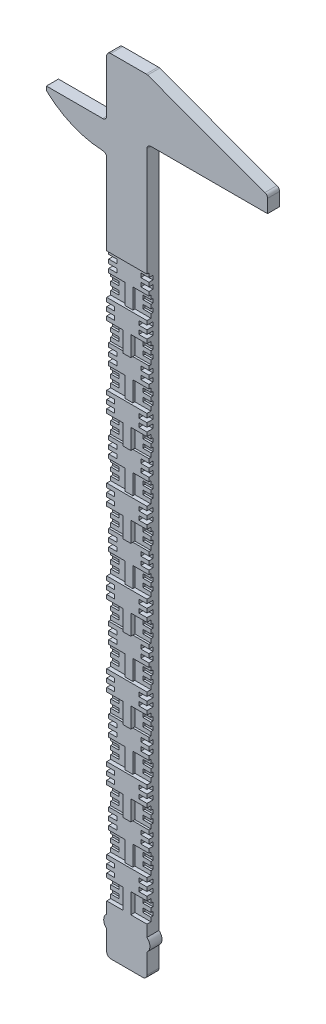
SolidWorks part; units mm, degrees
ref_plane "Plan de face" through (0, 0, 0) normal (0, 0, 1) x (1, 0, 0)
ref_plane "Plan de dessus" through (0, 0, 0) normal (0, 1, 0) x (1, 0, 0)
ref_plane "Plan de droite" through (0, 0, 0) normal (1, 0, 0) x (0, 0, -1)
sketch "Esquisse1" plane through (0, 0, 0) normal (0, 0, 1) x (1, 0, 0)
  line L0 (10.1667, 14.9389) -> (39.3443, 4.2404)
  line L3 (1, -180) -> (9, -180)
  line L4 (10, -1) -> (10, -170.8775)
  line L5 (-15, 0) -> (-15, -1)
  line L6 (11, 0) -> (40, 0)
  line L7 (40, 0) -> (40, 3.3016)
  line L8 (1, 15) -> (9.8224, 15)
  line L9 (0, -179) -> (0, -174)
  line L10 (-15, 0) -> (-1, 0)
  line L11 (0, 1) -> (0, 14)
  line L12 (5, -180) -> (5, -172.4538) construction
  line L13 (10, -174) -> (10, -179)
  line L14 (0, -170.8775) -> (0, -7.9099)
  arc A0 (-15, -1) -> (-0.9564, -6.9108) centre (0, 15) ccw
  arc A1 (0, -7.9099) -> (-0.9564, -6.9108) centre (-1, -7.9099) ccw
  arc A2 (-1, 0) -> (0, 1) centre (-1, 1) ccw
  arc A3 (11, 0) -> (10, -1) centre (11, -1) ccw
  arc A4 (40, 3.3016) -> (39.3443, 4.2404) centre (39, 3.3016) ccw
  arc A5 (9.8224, 15) -> (10.1667, 14.9389) centre (9.8224, 14) cw
  arc A6 (1, 15) -> (0, 14) centre (1, 14) ccw
  arc A7 (0, -179) -> (1, -180) centre (1, -179) ccw
  arc A8 (9, -180) -> (10, -179) centre (9, -179) ccw
  arc A9 (10, -170.8775) -> (10, -174) centre (8.75, -172.4388) cw
  arc A10 (0, -170.8775) -> (0, -174) centre (1.25, -172.4388) ccw
  point P20 (0, 0)
  point P23 (10, 0)
  point P26 (40, 4)
  point P29 (10, 15)
  point P35 (0, -180)
  point P38 (10, -180)
  point P41 (0, 0)
  dimension "D8" = 1
  dimension "D9" = 1
  dimension "D10" = 2
  dimension "D1" = 10
  dimension "D2" = 15
  dimension "D3" = 1
  dimension "D4" = 4
  dimension "D5" = 15
  dimension "D6" = 30
  dimension "D7" = 180
  dimension "D11" = 3.75
  dimension "D12" = 5
extrude "Boss.-Extru.1" add sketch "Esquisse1" along normal blind 3
sketch "Esquisse3" plane through (10, 0, 0) normal (1, 0, 0) x (0, 0, -1)
  line L0 (-6, -28.0143) -> (-2.5, -28.0143)
  line L1 (-2.5, -28.0143) -> (-2.5, -38.0143)
  line L2 (-5.9, -28.0143) -> (-6, -28.0143) construction
  line L3 (-2.5, -38.0143) -> (-6, -38.0143)
  line L4 (-6, -28.0143) -> (-6, -38.0143)
  line L5 (-6, -41.6651) -> (-6, -14.3635) construction
  line L6 (-3, -41.6651) -> (-3, -14.3635) construction
  line L7 (-6, -48.0143) -> (-6, -58.0143)
  line L8 (-2.5, -58.0143) -> (-6, -58.0143)
  line L9 (-2.5, -48.0143) -> (-2.5, -58.0143)
  line L10 (-6, -48.0143) -> (-2.5, -48.0143)
  line L11 (-6, -68.0143) -> (-6, -78.0143)
  line L12 (-2.5, -78.0143) -> (-6, -78.0143)
  line L13 (-2.5, -68.0143) -> (-2.5, -78.0143)
  line L14 (-6, -68.0143) -> (-2.5, -68.0143)
  line L15 (-6, -88.0143) -> (-6, -98.0143)
  line L16 (-2.5, -98.0143) -> (-6, -98.0143)
  line L17 (-2.5, -88.0143) -> (-2.5, -98.0143)
  line L18 (-6, -88.0143) -> (-2.5, -88.0143)
  line L19 (-6, -108.0143) -> (-6, -118.0143)
  line L20 (-2.5, -118.0143) -> (-6, -118.0143)
  line L21 (-2.5, -108.0143) -> (-2.5, -118.0143)
  line L22 (-6, -108.0143) -> (-2.5, -108.0143)
  line L23 (-6, -128.0143) -> (-6, -138.0143)
  line L24 (-2.5, -138.0143) -> (-6, -138.0143)
  line L25 (-2.5, -128.0143) -> (-2.5, -138.0143)
  line L26 (-6, -128.0143) -> (-2.5, -128.0143)
  line L27 (-6, -148.0143) -> (-6, -158.0143)
  line L28 (-2.5, -158.0143) -> (-6, -158.0143)
  line L29 (-2.5, -148.0143) -> (-2.5, -158.0143)
  line L30 (-6, -148.0143) -> (-2.5, -148.0143)
  point P2 (0, 0)
  dimension "D1" = 0.5
  dimension "D2" = 10
  dimension "D4" = 10
  dimension "D3" = 7
extrude "Enlèv. mat.-Extru.2" cut sketch "Esquisse3" against normal up to vertex (10 mm away)
sketch "Esquisse4" plane through (10, 0, 0) normal (1, 0, 0) x (0, 0, -1)
  line L1 (-7.9219, -33.0143) -> (-2, -33.0143)
  line L2 (-7.9219, -33.0143) -> (-7.9219, -38.0143)
  line L3 (-7.9219, -38.0143) -> (-2, -38.0143)
  line L4 (-2, -33.0143) -> (-2, -38.0143)
  line L5 (-5.9, -28.0143) -> (-6, -28.0143) construction
  line L6 (-3, -48.0143) -> (-3, -38.0143) construction
  line L7 (-7.9219, -48.0143) -> (-2, -48.0143)
  line L8 (-7.9219, -43.0143) -> (-7.9219, -48.0143)
  line L9 (-2, -43.0143) -> (-2, -48.0143)
  line L10 (-7.9219, -43.0143) -> (-2, -43.0143)
  line L11 (-7.9219, -58.0143) -> (-2, -58.0143)
  line L12 (-7.9219, -53.0143) -> (-7.9219, -58.0143)
  line L13 (-2, -53.0143) -> (-2, -58.0143)
  line L14 (-7.9219, -53.0143) -> (-2, -53.0143)
  line L15 (-7.9219, -68.0143) -> (-2, -68.0143)
  line L16 (-7.9219, -63.0143) -> (-7.9219, -68.0143)
  line L17 (-2, -63.0143) -> (-2, -68.0143)
  line L18 (-7.9219, -63.0143) -> (-2, -63.0143)
  line L19 (-7.9219, -78.0143) -> (-2, -78.0143)
  line L20 (-7.9219, -73.0143) -> (-7.9219, -78.0143)
  line L21 (-2, -73.0143) -> (-2, -78.0143)
  line L22 (-7.9219, -73.0143) -> (-2, -73.0143)
  line L23 (-7.9219, -88.0143) -> (-2, -88.0143)
  line L24 (-7.9219, -83.0143) -> (-7.9219, -88.0143)
  line L25 (-2, -83.0143) -> (-2, -88.0143)
  line L26 (-7.9219, -83.0143) -> (-2, -83.0143)
  line L27 (-7.9219, -98.0143) -> (-2, -98.0143)
  line L28 (-7.9219, -93.0143) -> (-7.9219, -98.0143)
  line L29 (-2, -93.0143) -> (-2, -98.0143)
  line L30 (-7.9219, -93.0143) -> (-2, -93.0143)
  line L31 (-7.9219, -108.0143) -> (-2, -108.0143)
  line L32 (-7.9219, -103.0143) -> (-7.9219, -108.0143)
  line L33 (-2, -103.0143) -> (-2, -108.0143)
  line L34 (-7.9219, -103.0143) -> (-2, -103.0143)
  line L35 (-7.9219, -118.0143) -> (-2, -118.0143)
  line L36 (-7.9219, -113.0143) -> (-7.9219, -118.0143)
  line L37 (-2, -113.0143) -> (-2, -118.0143)
  line L38 (-7.9219, -113.0143) -> (-2, -113.0143)
  line L39 (-7.9219, -128.0143) -> (-2, -128.0143)
  line L40 (-7.9219, -123.0143) -> (-7.9219, -128.0143)
  line L41 (-2, -123.0143) -> (-2, -128.0143)
  line L42 (-7.9219, -123.0143) -> (-2, -123.0143)
  line L43 (-7.9219, -138.0143) -> (-2, -138.0143)
  line L44 (-7.9219, -133.0143) -> (-7.9219, -138.0143)
  line L45 (-2, -133.0143) -> (-2, -138.0143)
  line L46 (-7.9219, -133.0143) -> (-2, -133.0143)
  line L47 (-7.9219, -148.0143) -> (-2, -148.0143)
  line L48 (-7.9219, -143.0143) -> (-7.9219, -148.0143)
  line L49 (-2, -143.0143) -> (-2, -148.0143)
  line L50 (-7.9219, -143.0143) -> (-2, -143.0143)
  line L51 (-7.9219, -158.0143) -> (-2, -158.0143)
  line L52 (-7.9219, -153.0143) -> (-7.9219, -158.0143)
  line L53 (-2, -153.0143) -> (-2, -158.0143)
  line L54 (-7.9219, -153.0143) -> (-2, -153.0143)
  line L55 (-7.9219, -168.0143) -> (-2, -168.0143)
  line L56 (-7.9219, -163.0143) -> (-7.9219, -168.0143)
  line L57 (-2, -163.0143) -> (-2, -168.0143)
  line L58 (-7.9219, -163.0143) -> (-2, -163.0143)
  dimension "D1" = 5
  dimension "D2" = 5
  dimension "D3" = 1
  dimension "D4" = 5.9219
  dimension "D6" = 5
  dimension "D5" = 14
extrude "Enlèv. mat.-Extru.3" cut sketch "Esquisse4" against normal blind 4
ref_plane "Plan1" through (5, 0, 0) normal (-1, 0, 0) x (0, 0, 1)
mirror "Symétrie1" about plane through (5, 0, 0) normal (-1, 0, 0) of "Enlèv. mat.-Extru.3"
sketch "Esquisse5" plane through (10, 0, 0) normal (1, 0, 0) x (0, 0, -1)
  line L0 (-3, -168.0143) -> (-2, -168.0143) construction
  line L1 (-1.5, -166.0143) -> (-9.9964, -166.0143)
  line L2 (-1.5, -166.0143) -> (-1.5, -167.0143)
  line L3 (-1.5, -167.0143) -> (-9.9964, -167.0143)
  line L4 (-9.9964, -166.0143) -> (-9.9964, -167.0143)
  line L5 (0, -170.8775) -> (0, -1) construction
  line L6 (-3, -170.8775) -> (-3, -168.0143) construction
  line L7 (-2, -165.5143) -> (-7.8593, -165.5143) construction
  line L8 (-2, -168.0143) -> (-2, -163.0143) construction
  line L9 (-1.5, -165.0143) -> (-1.5, -164.0143)
  line L10 (-1.5, -164.0143) -> (-9.9964, -164.0143)
  line L11 (-1.5, -165.0143) -> (-9.9964, -165.0143)
  line L12 (-9.9964, -165.0143) -> (-9.9964, -164.0143)
  line L13 (-9.9964, -160.0143) -> (-9.9964, -159.0143)
  line L14 (-1.5, -159.0143) -> (-9.9964, -159.0143)
  line L15 (-1.5, -160.0143) -> (-9.9964, -160.0143)
  line L16 (-1.5, -160.0143) -> (-1.5, -159.0143)
  line L17 (-1.5, -162.0143) -> (-9.9964, -162.0143)
  line L18 (-9.9964, -161.0143) -> (-9.9964, -162.0143)
  line L19 (-1.5, -161.0143) -> (-9.9964, -161.0143)
  line L20 (-1.5, -161.0143) -> (-1.5, -162.0143)
  line L21 (-9.9964, -155.0143) -> (-9.9964, -154.0143)
  line L22 (-1.5, -154.0143) -> (-9.9964, -154.0143)
  line L23 (-1.5, -155.0143) -> (-9.9964, -155.0143)
  line L24 (-1.5, -155.0143) -> (-1.5, -154.0143)
  line L25 (-1.5, -157.0143) -> (-9.9964, -157.0143)
  line L26 (-9.9964, -156.0143) -> (-9.9964, -157.0143)
  line L27 (-1.5, -156.0143) -> (-9.9964, -156.0143)
  line L28 (-1.5, -156.0143) -> (-1.5, -157.0143)
  line L29 (-9.9964, -150.0143) -> (-9.9964, -149.0143)
  line L30 (-1.5, -149.0143) -> (-9.9964, -149.0143)
  line L31 (-1.5, -150.0143) -> (-9.9964, -150.0143)
  line L32 (-1.5, -150.0143) -> (-1.5, -149.0143)
  line L33 (-1.5, -152.0143) -> (-9.9964, -152.0143)
  line L34 (-9.9964, -151.0143) -> (-9.9964, -152.0143)
  line L35 (-1.5, -151.0143) -> (-9.9964, -151.0143)
  line L36 (-1.5, -151.0143) -> (-1.5, -152.0143)
  line L37 (-9.9964, -145.0143) -> (-9.9964, -144.0143)
  line L38 (-1.5, -144.0143) -> (-9.9964, -144.0143)
  line L39 (-1.5, -145.0143) -> (-9.9964, -145.0143)
  line L40 (-1.5, -145.0143) -> (-1.5, -144.0143)
  line L41 (-1.5, -147.0143) -> (-9.9964, -147.0143)
  line L42 (-9.9964, -146.0143) -> (-9.9964, -147.0143)
  line L43 (-1.5, -146.0143) -> (-9.9964, -146.0143)
  line L44 (-1.5, -146.0143) -> (-1.5, -147.0143)
  line L45 (-9.9964, -140.0143) -> (-9.9964, -139.0143)
  line L46 (-1.5, -139.0143) -> (-9.9964, -139.0143)
  line L47 (-1.5, -140.0143) -> (-9.9964, -140.0143)
  line L48 (-1.5, -140.0143) -> (-1.5, -139.0143)
  line L49 (-1.5, -142.0143) -> (-9.9964, -142.0143)
  line L50 (-9.9964, -141.0143) -> (-9.9964, -142.0143)
  line L51 (-1.5, -141.0143) -> (-9.9964, -141.0143)
  line L52 (-1.5, -141.0143) -> (-1.5, -142.0143)
  line L53 (-9.9964, -135.0143) -> (-9.9964, -134.0143)
  line L54 (-1.5, -134.0143) -> (-9.9964, -134.0143)
  line L55 (-1.5, -135.0143) -> (-9.9964, -135.0143)
  line L56 (-1.5, -135.0143) -> (-1.5, -134.0143)
  line L57 (-1.5, -137.0143) -> (-9.9964, -137.0143)
  line L58 (-9.9964, -136.0143) -> (-9.9964, -137.0143)
  line L59 (-1.5, -136.0143) -> (-9.9964, -136.0143)
  line L60 (-1.5, -136.0143) -> (-1.5, -137.0143)
  line L61 (-9.9964, -130.0143) -> (-9.9964, -129.0143)
  line L62 (-1.5, -129.0143) -> (-9.9964, -129.0143)
  line L63 (-1.5, -130.0143) -> (-9.9964, -130.0143)
  line L64 (-1.5, -130.0143) -> (-1.5, -129.0143)
  line L65 (-1.5, -132.0143) -> (-9.9964, -132.0143)
  line L66 (-9.9964, -131.0143) -> (-9.9964, -132.0143)
  line L67 (-1.5, -131.0143) -> (-9.9964, -131.0143)
  line L68 (-1.5, -131.0143) -> (-1.5, -132.0143)
  line L69 (-9.9964, -125.0143) -> (-9.9964, -124.0143)
  line L70 (-1.5, -124.0143) -> (-9.9964, -124.0143)
  line L71 (-1.5, -125.0143) -> (-9.9964, -125.0143)
  line L72 (-1.5, -125.0143) -> (-1.5, -124.0143)
  line L73 (-1.5, -127.0143) -> (-9.9964, -127.0143)
  line L74 (-9.9964, -126.0143) -> (-9.9964, -127.0143)
  line L75 (-1.5, -126.0143) -> (-9.9964, -126.0143)
  line L76 (-1.5, -126.0143) -> (-1.5, -127.0143)
  line L77 (-9.9964, -120.0143) -> (-9.9964, -119.0143)
  line L78 (-1.5, -119.0143) -> (-9.9964, -119.0143)
  line L79 (-1.5, -120.0143) -> (-9.9964, -120.0143)
  line L80 (-1.5, -120.0143) -> (-1.5, -119.0143)
  line L81 (-1.5, -122.0143) -> (-9.9964, -122.0143)
  line L82 (-9.9964, -121.0143) -> (-9.9964, -122.0143)
  line L83 (-1.5, -121.0143) -> (-9.9964, -121.0143)
  line L84 (-1.5, -121.0143) -> (-1.5, -122.0143)
  line L85 (-9.9964, -115.0143) -> (-9.9964, -114.0143)
  line L86 (-1.5, -114.0143) -> (-9.9964, -114.0143)
  line L87 (-1.5, -115.0143) -> (-9.9964, -115.0143)
  line L88 (-1.5, -115.0143) -> (-1.5, -114.0143)
  line L89 (-1.5, -117.0143) -> (-9.9964, -117.0143)
  line L90 (-9.9964, -116.0143) -> (-9.9964, -117.0143)
  line L91 (-1.5, -116.0143) -> (-9.9964, -116.0143)
  line L92 (-1.5, -116.0143) -> (-1.5, -117.0143)
  line L93 (-9.9964, -110.0143) -> (-9.9964, -109.0143)
  line L94 (-1.5, -109.0143) -> (-9.9964, -109.0143)
  line L95 (-1.5, -110.0143) -> (-9.9964, -110.0143)
  line L96 (-1.5, -110.0143) -> (-1.5, -109.0143)
  line L97 (-1.5, -112.0143) -> (-9.9964, -112.0143)
  line L98 (-9.9964, -111.0143) -> (-9.9964, -112.0143)
  line L99 (-1.5, -111.0143) -> (-9.9964, -111.0143)
  line L100 (-1.5, -111.0143) -> (-1.5, -112.0143)
  line L101 (-9.9964, -105.0143) -> (-9.9964, -104.0143)
  line L102 (-1.5, -104.0143) -> (-9.9964, -104.0143)
  line L103 (-1.5, -105.0143) -> (-9.9964, -105.0143)
  line L104 (-1.5, -105.0143) -> (-1.5, -104.0143)
  line L105 (-1.5, -107.0143) -> (-9.9964, -107.0143)
  line L106 (-9.9964, -106.0143) -> (-9.9964, -107.0143)
  line L107 (-1.5, -106.0143) -> (-9.9964, -106.0143)
  line L108 (-1.5, -106.0143) -> (-1.5, -107.0143)
  line L109 (-9.9964, -100.0143) -> (-9.9964, -99.0143)
  line L110 (-1.5, -99.0143) -> (-9.9964, -99.0143)
  line L111 (-1.5, -100.0143) -> (-9.9964, -100.0143)
  line L112 (-1.5, -100.0143) -> (-1.5, -99.0143)
  line L113 (-1.5, -102.0143) -> (-9.9964, -102.0143)
  line L114 (-9.9964, -101.0143) -> (-9.9964, -102.0143)
  line L115 (-1.5, -101.0143) -> (-9.9964, -101.0143)
  line L116 (-1.5, -101.0143) -> (-1.5, -102.0143)
  line L117 (-9.9964, -95.0143) -> (-9.9964, -94.0143)
  line L118 (-1.5, -94.0143) -> (-9.9964, -94.0143)
  line L119 (-1.5, -95.0143) -> (-9.9964, -95.0143)
  line L120 (-1.5, -95.0143) -> (-1.5, -94.0143)
  line L121 (-1.5, -97.0143) -> (-9.9964, -97.0143)
  line L122 (-9.9964, -96.0143) -> (-9.9964, -97.0143)
  line L123 (-1.5, -96.0143) -> (-9.9964, -96.0143)
  line L124 (-1.5, -96.0143) -> (-1.5, -97.0143)
  line L125 (-9.9964, -90.0143) -> (-9.9964, -89.0143)
  line L126 (-1.5, -89.0143) -> (-9.9964, -89.0143)
  line L127 (-1.5, -90.0143) -> (-9.9964, -90.0143)
  line L128 (-1.5, -90.0143) -> (-1.5, -89.0143)
  line L129 (-1.5, -92.0143) -> (-9.9964, -92.0143)
  line L130 (-9.9964, -91.0143) -> (-9.9964, -92.0143)
  line L131 (-1.5, -91.0143) -> (-9.9964, -91.0143)
  line L132 (-1.5, -91.0143) -> (-1.5, -92.0143)
  line L133 (-9.9964, -85.0143) -> (-9.9964, -84.0143)
  line L134 (-1.5, -84.0143) -> (-9.9964, -84.0143)
  line L135 (-1.5, -85.0143) -> (-9.9964, -85.0143)
  line L136 (-1.5, -85.0143) -> (-1.5, -84.0143)
  line L137 (-1.5, -87.0143) -> (-9.9964, -87.0143)
  line L138 (-9.9964, -86.0143) -> (-9.9964, -87.0143)
  line L139 (-1.5, -86.0143) -> (-9.9964, -86.0143)
  line L140 (-1.5, -86.0143) -> (-1.5, -87.0143)
  line L141 (-9.9964, -80.0143) -> (-9.9964, -79.0143)
  line L142 (-1.5, -79.0143) -> (-9.9964, -79.0143)
  line L143 (-1.5, -80.0143) -> (-9.9964, -80.0143)
  line L144 (-1.5, -80.0143) -> (-1.5, -79.0143)
  line L145 (-1.5, -82.0143) -> (-9.9964, -82.0143)
  line L146 (-9.9964, -81.0143) -> (-9.9964, -82.0143)
  line L147 (-1.5, -81.0143) -> (-9.9964, -81.0143)
  line L148 (-1.5, -81.0143) -> (-1.5, -82.0143)
  line L149 (-9.9964, -75.0143) -> (-9.9964, -74.0143)
  line L150 (-1.5, -74.0143) -> (-9.9964, -74.0143)
  line L151 (-1.5, -75.0143) -> (-9.9964, -75.0143)
  line L152 (-1.5, -75.0143) -> (-1.5, -74.0143)
  line L153 (-1.5, -77.0143) -> (-9.9964, -77.0143)
  line L154 (-9.9964, -76.0143) -> (-9.9964, -77.0143)
  line L155 (-1.5, -76.0143) -> (-9.9964, -76.0143)
  line L156 (-1.5, -76.0143) -> (-1.5, -77.0143)
  line L157 (-9.9964, -70.0143) -> (-9.9964, -69.0143)
  line L158 (-1.5, -69.0143) -> (-9.9964, -69.0143)
  line L159 (-1.5, -70.0143) -> (-9.9964, -70.0143)
  line L160 (-1.5, -70.0143) -> (-1.5, -69.0143)
  line L161 (-1.5, -72.0143) -> (-9.9964, -72.0143)
  line L162 (-9.9964, -71.0143) -> (-9.9964, -72.0143)
  line L163 (-1.5, -71.0143) -> (-9.9964, -71.0143)
  line L164 (-1.5, -71.0143) -> (-1.5, -72.0143)
  line L165 (-9.9964, -65.0143) -> (-9.9964, -64.0143)
  line L166 (-1.5, -64.0143) -> (-9.9964, -64.0143)
  line L167 (-1.5, -65.0143) -> (-9.9964, -65.0143)
  line L168 (-1.5, -65.0143) -> (-1.5, -64.0143)
  line L169 (-1.5, -67.0143) -> (-9.9964, -67.0143)
  line L170 (-9.9964, -66.0143) -> (-9.9964, -67.0143)
  line L171 (-1.5, -66.0143) -> (-9.9964, -66.0143)
  line L172 (-1.5, -66.0143) -> (-1.5, -67.0143)
  line L173 (-9.9964, -60.0143) -> (-9.9964, -59.0143)
  line L174 (-1.5, -59.0143) -> (-9.9964, -59.0143)
  line L175 (-1.5, -60.0143) -> (-9.9964, -60.0143)
  line L176 (-1.5, -60.0143) -> (-1.5, -59.0143)
  line L177 (-1.5, -62.0143) -> (-9.9964, -62.0143)
  line L178 (-9.9964, -61.0143) -> (-9.9964, -62.0143)
  line L179 (-1.5, -61.0143) -> (-9.9964, -61.0143)
  line L180 (-1.5, -61.0143) -> (-1.5, -62.0143)
  line L181 (-9.9964, -55.0143) -> (-9.9964, -54.0143)
  line L182 (-1.5, -54.0143) -> (-9.9964, -54.0143)
  line L183 (-1.5, -55.0143) -> (-9.9964, -55.0143)
  line L184 (-1.5, -55.0143) -> (-1.5, -54.0143)
  line L185 (-1.5, -57.0143) -> (-9.9964, -57.0143)
  line L186 (-9.9964, -56.0143) -> (-9.9964, -57.0143)
  line L187 (-1.5, -56.0143) -> (-9.9964, -56.0143)
  line L188 (-1.5, -56.0143) -> (-1.5, -57.0143)
  line L189 (-9.9964, -50.0143) -> (-9.9964, -49.0143)
  line L190 (-1.5, -49.0143) -> (-9.9964, -49.0143)
  line L191 (-1.5, -50.0143) -> (-9.9964, -50.0143)
  line L192 (-1.5, -50.0143) -> (-1.5, -49.0143)
  line L193 (-1.5, -52.0143) -> (-9.9964, -52.0143)
  line L194 (-9.9964, -51.0143) -> (-9.9964, -52.0143)
  line L195 (-1.5, -51.0143) -> (-9.9964, -51.0143)
  line L196 (-1.5, -51.0143) -> (-1.5, -52.0143)
  line L197 (-9.9964, -45.0143) -> (-9.9964, -44.0143)
  line L198 (-1.5, -44.0143) -> (-9.9964, -44.0143)
  line L199 (-1.5, -45.0143) -> (-9.9964, -45.0143)
  line L200 (-1.5, -45.0143) -> (-1.5, -44.0143)
  line L201 (-1.5, -47.0143) -> (-9.9964, -47.0143)
  line L202 (-9.9964, -46.0143) -> (-9.9964, -47.0143)
  line L203 (-1.5, -46.0143) -> (-9.9964, -46.0143)
  line L204 (-1.5, -46.0143) -> (-1.5, -47.0143)
  line L205 (-9.9964, -40.0143) -> (-9.9964, -39.0143)
  line L206 (-1.5, -39.0143) -> (-9.9964, -39.0143)
  line L207 (-1.5, -40.0143) -> (-9.9964, -40.0143)
  line L208 (-1.5, -40.0143) -> (-1.5, -39.0143)
  line L209 (-1.5, -42.0143) -> (-9.9964, -42.0143)
  line L210 (-9.9964, -41.0143) -> (-9.9964, -42.0143)
  line L211 (-1.5, -41.0143) -> (-9.9964, -41.0143)
  line L212 (-1.5, -41.0143) -> (-1.5, -42.0143)
  line L213 (-9.9964, -35.0143) -> (-9.9964, -34.0143)
  line L214 (-1.5, -34.0143) -> (-9.9964, -34.0143)
  line L215 (-1.5, -35.0143) -> (-9.9964, -35.0143)
  line L216 (-1.5, -35.0143) -> (-1.5, -34.0143)
  line L217 (-1.5, -37.0143) -> (-9.9964, -37.0143)
  line L218 (-9.9964, -36.0143) -> (-9.9964, -37.0143)
  line L219 (-1.5, -36.0143) -> (-9.9964, -36.0143)
  line L220 (-1.5, -36.0143) -> (-1.5, -37.0143)
  line L221 (-9.9964, -30.0143) -> (-9.9964, -29.0143)
  line L222 (-1.5, -29.0143) -> (-9.9964, -29.0143)
  line L223 (-1.5, -30.0143) -> (-9.9964, -30.0143)
  line L224 (-1.5, -30.0143) -> (-1.5, -29.0143)
  line L225 (-1.5, -32.0143) -> (-9.9964, -32.0143)
  line L226 (-9.9964, -31.0143) -> (-9.9964, -32.0143)
  line L227 (-1.5, -31.0143) -> (-9.9964, -31.0143)
  line L228 (-1.5, -31.0143) -> (-1.5, -32.0143)
  point P8 (-1.5, -164.5143)
  point P9 (0, 0)
  point P10 (0, 0)
  point P15 (-9.9964, -166.5143)
  dimension "D1" = 1
  dimension "D2" = 1
  dimension "D3" = 1.5
  dimension "D4" = 6.9964
  dimension "D6" = 2
  dimension "D5" = 28
extrude "Enlèv. mat.-Extru.4" cut sketch "Esquisse5" against normal blind 2
mirror "Symétrie2" about plane through (5, 0, 0) normal (-1, 0, 0) of "Enlèv. mat.-Extru.4"
